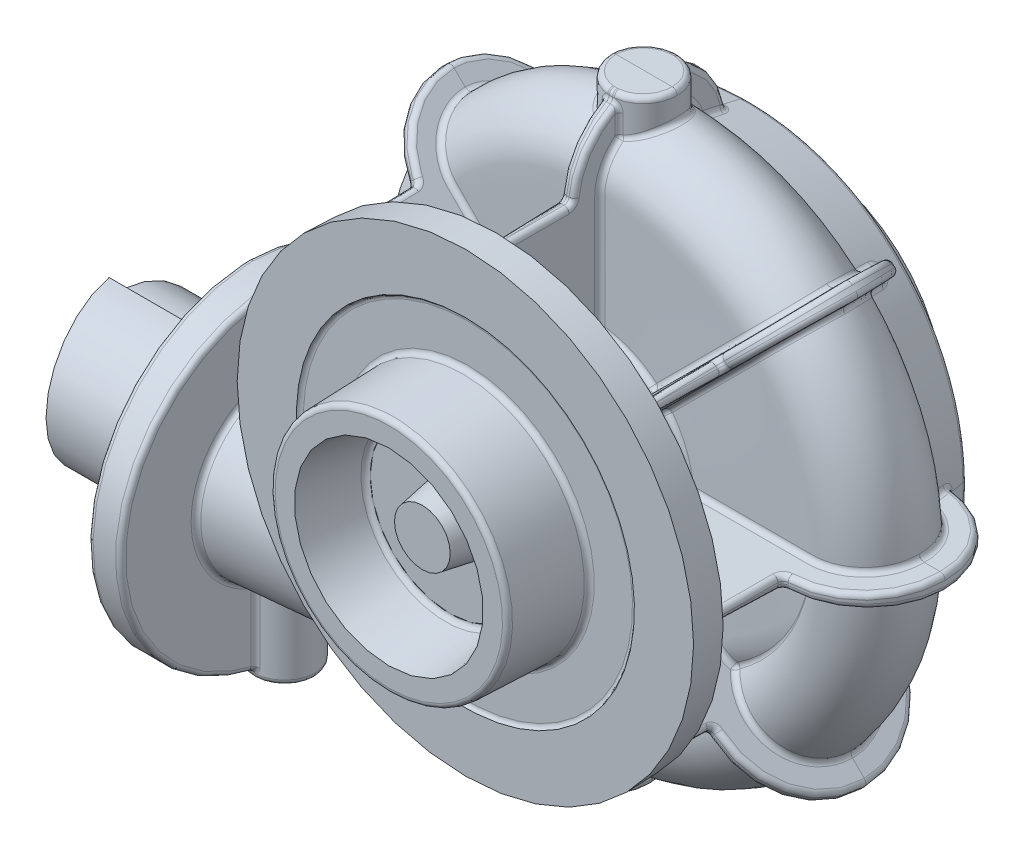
SolidWorks part; units mm, degrees
ref_plane "Plan de face" through (0, 0, 0) normal (0, 0, 1) x (1, 0, 0)
ref_plane "Plan de dessus" through (0, 0, 0) normal (0, 1, 0) x (1, 0, 0)
ref_plane "Plan de droite" through (0, 0, 0) normal (1, 0, 0) x (0, 0, -1)
other "Joindre1"
other "CARTER POMPE BRUTE SANS RETRAIT<1>@E D M"
other "NOYAU<1>@E D M"
sketch "Esquisse4" plane through (-201.9114, 0, 0) normal (-1, 0, 0) x (0, 0, 1)
  line L0 (0, -61.7722) -> (0, -120.5063)
  arc A0 (0, -61.7722) -> (0, -120.5063) centre (0, -91.1392) ccw construction
  arc A1 (0, -61.7722) -> (0, -120.5063) centre (0, -91.1392) ccw
extrude "Extrusion1" add sketch "Esquisse4" along normal blind 2
sketch "Esquisse5" plane through (-203.9114, 0, 0) normal (-1, 0, 0) x (0, 0, 1)
  line L1 (0, -120.5063) -> (0, -61.7722)
  line L2 (0, -120.5063) -> (0, -61.7722)
  arc A1 (0, -61.7722) -> (0, -120.5063) centre (0, -91.1392) ccw
  arc A2 (0, -61.7722) -> (0, -120.5063) centre (0, -91.1392) ccw
  dimension "D1" = 0
extrude "Extrusion2" add sketch "Esquisse5" along normal blind 2.57
draft "Dépouille1" type of draft neutral plane draft angle 5 faces to draft 1 parameters "D1"=5
sketch "Esquisse6" plane through (-201.9114, 0, 0) normal (-1, 0, 0) x (0, 0, 1)
  line L0 (0, -60.7722) -> (0, -121.5063)
  arc A3 (0, -121.5063) -> (0, -60.7722) centre (0, -91.1392) ccw
  arc A4 (0, -121.5063) -> (0, -60.7722) centre (0, -91.1392) ccw
  dimension "D1" = 1
extrude "Extrusion3" add sketch "Esquisse6" against normal up to surface (44.9494 mm away)
sketch "Esquisse7" plane through (-201.9114, 0, 0) normal (-1, 0, 0) x (0, 0, 1)
  line L3 (0, -61.7722) -> (0, -120.5063)
  line L4 (0, -120.5063) -> (0, -121.5063)
  line L5 (0, -60.7722) -> (0, -61.7722)
  line L6 (0, -61.7722) -> (0, -120.5063)
  line L7 (0, -120.5063) -> (0, -121.5063)
  line L8 (0, -60.7722) -> (0, -61.7722)
  arc A1 (0, -121.5063) -> (0, -60.7722) centre (0, -91.1392) ccw
  arc A2 (0, -121.5063) -> (0, -60.7722) centre (0, -91.1392) ccw
  dimension "D1" = 0
extrude "Extrusion4" add sketch "Esquisse7" along normal blind 5
sketch "Esquisse8" plane through (-206.9114, 0, 0) normal (-1, 0, 0) x (0, 0, 1)
  line L1 (0, -60.7722) -> (0, -121.5063)
  line L2 (0, -60.7722) -> (0, -121.5063)
  arc A1 (0, -121.5063) -> (0, -60.7722) centre (0, -91.1392) ccw
  arc A2 (0, -121.5063) -> (0, -60.7722) centre (0, -91.1392) ccw
  dimension "D1" = 0
extrude "Extrusion5" add sketch "Esquisse8" along normal blind 5.35
draft "Dépouille2" type of draft neutral plane draft angle 10 faces to draft 1 parameters "D1"=10
sketch "Esquisse9" plane through (0, 0, 0) normal (0, 1, 0) x (1, 0, 0)
  line L0 (59.3702, 39.7829) -> (57.6205, 59.7829) construction
  line L1 (59.3702, 39.7829) -> (57.6205, 59.7829)
  line L2 (57.6205, 59.7829) -> (-57.6205, 59.7829) construction
  line L3 (59.3702, 39.7829) -> (59.571, 39.7829)
  line L4 (86.4645, 39.7829) -> (0.0442, 39.7829) construction
  line L5 (57.7907, 60.1315) -> (59.571, 39.7829)
  line L6 (57.6205, 59.7829) -> (49.806, 59.7829)
  arc A0 (57.7907, 60.1315) -> (49.806, 59.7829) centre (53.806, 59.7829) ccw
  dimension "D2" = 8
  dimension "D1" = 0.2
revolve "Révolution1" add sketch "Esquisse9" angle 360 about axis through (0, 0, -39.7829) along (0, 0, 1)
sketch "Esquisse11" plane through (0, 0, 0) normal (0, 1, 0) x (1, 0, 0)
  line L0 (-10.739, -86.962) -> (10.739, -86.962) construction
  line L1 (10.739, -86.962) -> (12.5023, -76.962) construction
  line L2 (0, -86.962) -> (10.739, -86.962)
  line L3 (10.739, -86.962) -> (12.5023, -76.962)
  line L4 (12.5023, -76.962) -> (13.01, -76.962)
  line L5 (-31.702, -76.962) -> (31.702, -76.962) construction
  line L6 (0, -86.962) -> (0, -87.962)
  line L7 (0, -71.8281) -> (0, -99.3112) construction
  line L8 (0, -87.962) -> (11.0704, -87.962)
  line L9 (11.0704, -87.962) -> (13.01, -76.962)
  dimension "D1" = 1
  dimension "D2" = 0.5
revolve "Révolution2" add sketch "Esquisse11" angle 360 about axis through (0, 0, 101.2658) along (0, 0, -1)
